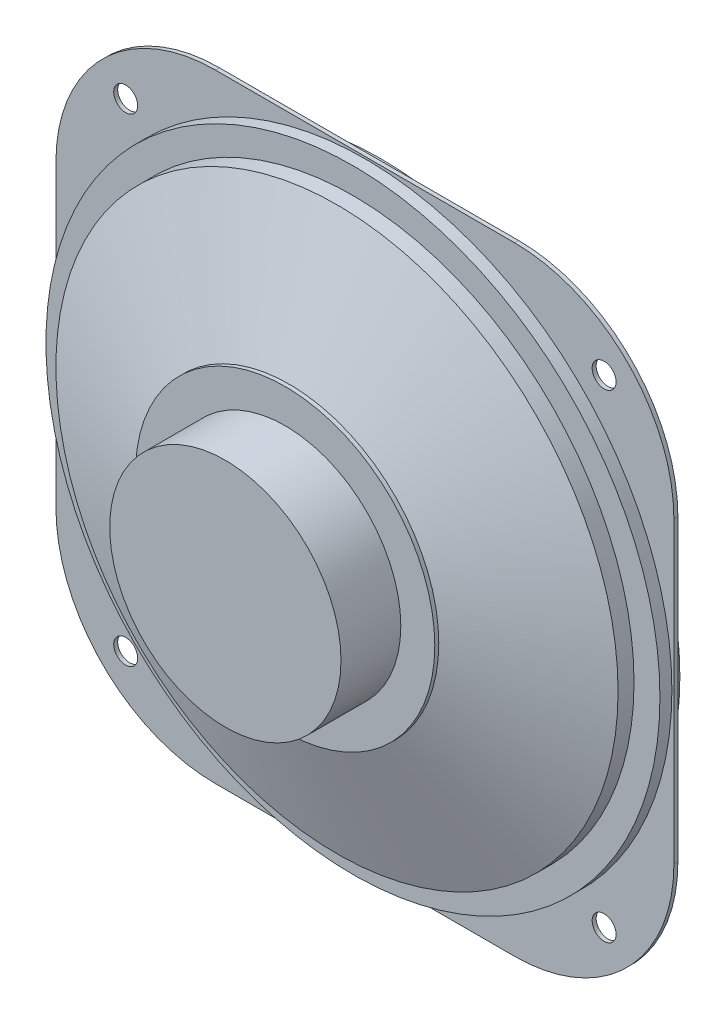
SolidWorks part; units mm, degrees
ref_plane "Plan de face" through (0, 0, 0) normal (0, 0, 1) x (1, 0, 0)
ref_plane "Plan de dessus" through (0, 0, 0) normal (0, 1, 0) x (1, 0, 0)
ref_plane "Plan de droite" through (0, 0, 0) normal (1, 0, 0) x (0, 0, -1)
sketch "Esquisse1" plane through (0, 0, 0) normal (0, 0, 1) x (1, 0, 0)
  line L0 (-30, -30) -> (30, 30) construction
  line L1 (30, -30) -> (-30, 30) construction
  line L3 (18.75, 38.75) -> (-18.75, 38.75)
  line L4 (38.75, 18.75) -> (38.75, -18.75)
  line L5 (18.75, -38.75) -> (-18.75, -38.75)
  line L6 (-38.75, 18.75) -> (-38.75, -18.75)
  line L7 (38.75, 38.75) -> (-38.75, -38.75) construction
  line L8 (38.75, -38.75) -> (-38.75, 38.75) construction
  circle A0 centre (0, 0) radius 38.5 construction
  circle A1 centre (-30, 30) radius 1.5 construction
  circle A2 centre (30, 30) radius 1.5 construction
  circle A3 centre (30, -30) radius 1.5 construction
  circle A4 centre (-30, -30) radius 1.5 construction
  circle A5 centre (0, 0) radius 38.5 construction
  circle A6 centre (-30, 30) radius 1.5
  circle A7 centre (30, 30) radius 1.5
  circle A8 centre (30, -30) radius 1.5
  circle A9 centre (-30, -30) radius 1.5
  circle A10 centre (0, 0) radius 46.5 construction
  arc A11 (18.75, -38.75) -> (38.75, -18.75) centre (18.75, -18.75) ccw
  arc A12 (38.75, 18.75) -> (18.75, 38.75) centre (18.75, 18.75) ccw
  arc A13 (-18.75, 38.75) -> (-38.75, 18.75) centre (-18.75, 18.75) ccw
  arc A14 (-18.75, -38.75) -> (-38.75, -18.75) centre (-18.75, -18.75) cw
  circle A15 centre (0, 0) radius 38.5
  dimension "D2" = 93
  dimension "D3" = 20
  dimension "D4" = 77
  dimension "D1" = 77.5
extrude "Boss.-Extru.1" add sketch "Esquisse1" along normal blind 0.5
sketch "Esquisse2" plane through (0, 0, 0.5) normal (0, 0, 1) x (1, 0, 0)
  circle A0 centre (0, 0) radius 38.5
  circle A1 centre (0, 0) radius 35.25
  dimension "D1" = 70.5
extrude "Boss.-Extru.2" add sketch "Esquisse2" along normal blind 1.5 separate body
sketch "Esquisse3" plane through (0, 0, 2) normal (0, 0, 1) x (1, 0, 0)
  circle A0 centre (0, 0) radius 18
  circle A1 centre (0, 0) radius 35.25 construction
  circle A2 centre (0, 0) radius 35.25
  dimension "D1" = 36
extrude "Boss.-Extru.3" add sketch "Esquisse3" along normal blind 8 separate body
chamfer "Chanfrein3" distance 6 angle 70 1 edges at (35.25, 0, 10)
sketch "Esquisse5" plane through (0, 0, 10) normal (0, 0, 1) x (1, 0, 0)
  circle A0 centre (0, 0) radius 18 construction
  circle A1 centre (0, 0) radius 14.5027
  circle A2 centre (0, 0) radius 18.7651
  point P2 (0, 0)
  point P6 (2.9962, 0)
  dimension "D1" = 29.0053
extrude "Boss.-Extru.4" add sketch "Esquisse5" along normal blind 0.5
sketch "Esquisse6" plane through (0, 0, 10.5) normal (0, 0, 1) x (1, 0, 0)
  circle A0 centre (0, 0) radius 14.5027 construction
  circle A1 centre (0, 0) radius 14.5027
extrude "Boss.-Extru.5" add sketch "Esquisse6" along normal blind 7.5 separate body
sketch "Esquisse7" plane through (0, 0, 0) normal (0, 0, -1) x (-1, 0, 0)
  circle A0 centre (0, 0) radius 35.5
  circle A1 centre (0, 0) radius 37.5
  dimension "D1" = 71
  dimension "D2" = 75
extrude "Boss.-Extru.7" add sketch "Esquisse7" along normal blind 1.5 and the other way blind 1.9
chamfer "Chanfrein4" distance 6 angle 70 1 edges at (18, 0, 2)
